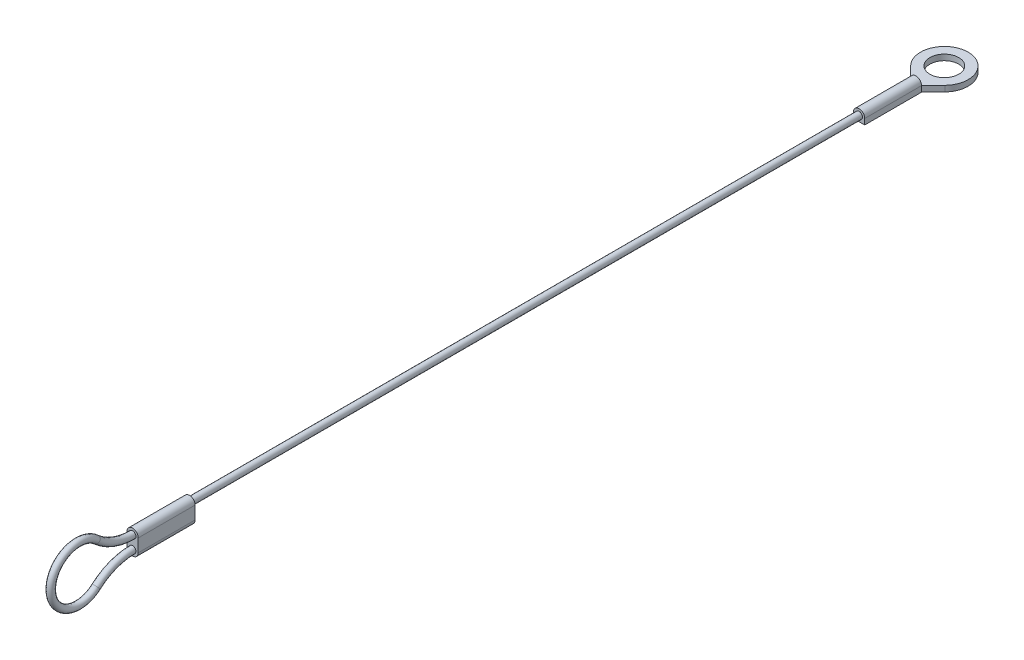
SolidWorks part; units mm, degrees
ref_plane "Front Plane" through (0, 0, 0) normal (0, 0, 1) x (1, 0, 0)
ref_plane "Top Plane" through (0, 0, 0) normal (0, 1, 0) x (1, 0, 0)
ref_plane "Right Plane" through (0, 0, 0) normal (1, 0, 0) x (0, 0, -1)
sketch "Sketch1" plane through (0, 0, 0) normal (1, 0, 0) x (0, 0, -1)
  line L2 (-127.8, 0) -> (0, 0)
  arc A0 (-127.8, 0) -> (-134.2, 2.4446) centre (-127.8, 9.6) cw
  arc A1 (-134.2, 2.4446) -> (-134.2, -4.7108) centre (-137.4, -1.1331) ccw
  arc A2 (-134.2, -4.7108) -> (-127.8, -2.2663) centre (-127.8, -11.8663) cw
  dimension "D1" = 4.8
  dimension "D4" = 9.6
  dimension "D2" = 137.4
  dimension "D3" = 9.6
sketch "Sketch2" plane through (0, 0, 0) normal (0, 0, 1) x (1, 0, 0)
  circle A0 centre (0, 0) radius 0.595
  dimension "D1" = 1.19
sweep "Sweep1" add profiles "Sketch2" path "Sketch1"
sketch "Sketch3" plane through (0, 0, 127.8) normal (0, 0, -1) x (-1, 0, 0)
  line L0 (0, 0) -> (0, -2.2663) construction
  line L1 (0.995, 0) -> (0.995, -2.2663)
  line L2 (-0.995, 0) -> (-0.995, -2.2663)
  line L3 (-0.595, -2.2663) -> (0.595, -2.2663) construction
  arc A0 (0.995, 0) -> (-0.995, 0) centre (0, 0) ccw
  arc A1 (-0.995, -2.2663) -> (0.995, -2.2663) centre (0, -2.2663) ccw
  point P3 (0, -1.1331)
  dimension "D1" = 1.99
extrude "Boss-Extrude1" add sketch "Sketch3" along normal blind 10
sketch "Sketch4" plane through (0, 0, 0) normal (0, 0, -1) x (-1, 0, 0)
  line L0 (-0.995, 0) -> (-0.995, -0.995)
  line L1 (-0.995, -0.995) -> (0, -0.995)
  line L2 (0, -0.995) -> (0.995, -0.995)
  line L3 (0.995, -0.995) -> (0.995, 0)
  arc A0 (0.995, 0) -> (-0.995, 0) centre (0, 0) ccw
  dimension "D1" = 1.99
extrude "Boss-Extrude2" add sketch "Sketch4" along normal blind 10
sketch "Sketch5" plane through (0, -0.995, 0) normal (0, -1, 0) x (1, 0, 0)
  line L0 (-0.995, -10) -> (0.995, -10)
  line L1 (0.995, -10) -> (3.0131, -12.0884)
  line L2 (-3.0131, -12.0884) -> (-0.995, -10)
  arc A0 (3.0131, -12.0884) -> (-3.0131, -12.0884) centre (0, -15) cw
  circle A1 centre (0, -15) radius 2.54
  point P8 (-4.19, -15)
  point P9 (4.19, -15)
  dimension "D1" = 5.08
  dimension "D2" = 8.38
  dimension "D3" = 15
extrude "Boss-Extrude3" add sketch "Sketch5" against normal blind 1.01
